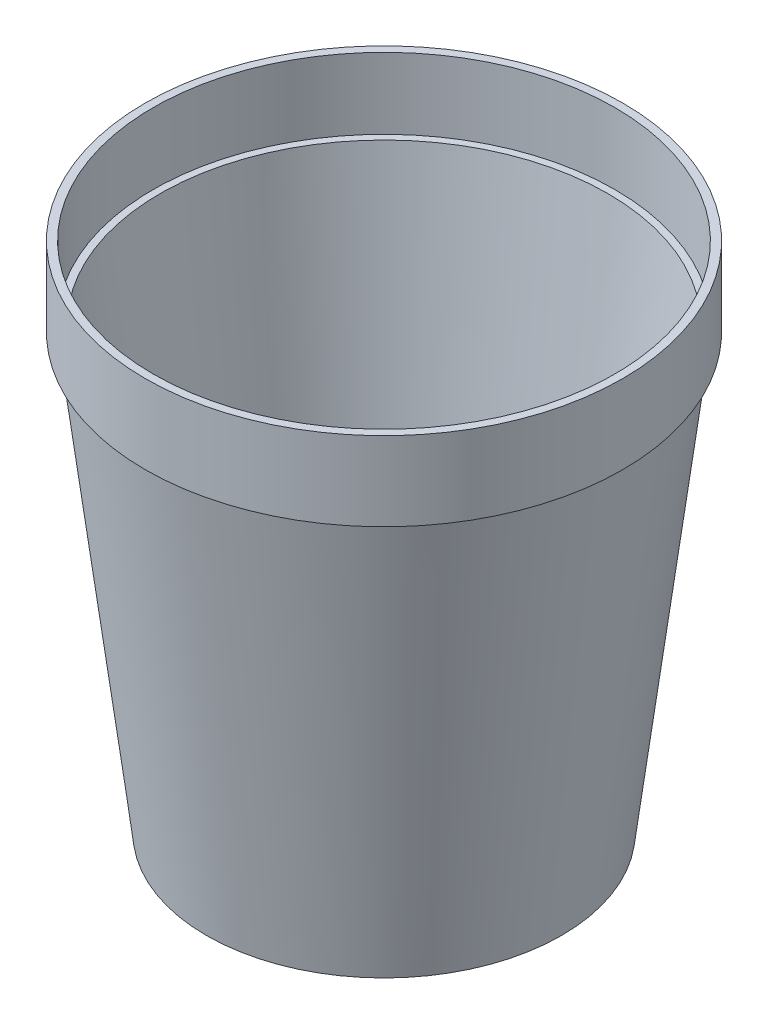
SolidWorks part; units mm, degrees
ref_plane "Front Plane" through (0, 0, 0) normal (0, 0, 1) x (1, 0, 0)
ref_plane "Top Plane" through (0, 0, 0) normal (0, 1, 0) x (1, 0, 0)
ref_plane "Right Plane" through (0, 0, 0) normal (1, 0, 0) x (0, 0, -1)
sketch "Sketch1" plane through (0, 0, 0) normal (0, 1, 0) x (1, 0, 0)
  line L1 (0, 0) -> (1200, 0) construction
  line L2 (0, 0) -> (0, 765) construction
  line L3 (0, 765) -> (1200, 765) construction
  line L4 (1200, 0) -> (1200, 765) construction
  dimension "D1" = 1200
  dimension "D2" = 765
sketch "Sketch3" plane through (0, 0, 0) normal (0, 0, 1) x (1, 0, 0)
  line L0 (0, 0) -> (0, 130)
  line L1 (0, 130) -> (60.5063, 130)
  line L2 (60.5063, 130) -> (60.5063, 110)
  line L3 (60.5063, 110) -> (58.5063, 110)
  line L4 (58.5063, 110) -> (45, 0)
  line L5 (0, 0) -> (1200, 0) construction
  line L6 (45, 0) -> (0, 0)
  dimension "D1" = 45
  dimension "D2" = 97
  dimension "D3" = 2
  dimension "D4" = 130
  dimension "D5" = 20
revolve "Revolve1" add sketch "Sketch3" angle 360 about L0
shell "Shell1" thickness 2
